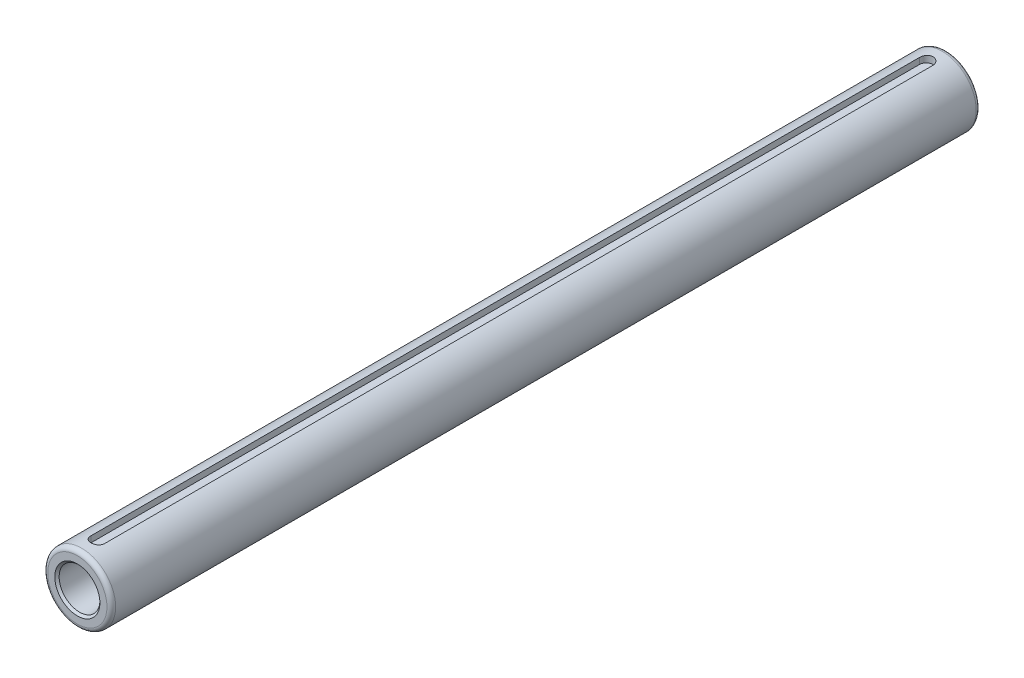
SolidWorks part; units mm, degrees
ref_plane "Front Plane" through (0, 0, 0) normal (0, 0, 1) x (1, 0, 0)
ref_plane "Top Plane" through (0, 0, 0) normal (0, 1, 0) x (1, 0, 0)
ref_plane "Right Plane" through (0, 0, 0) normal (1, 0, 0) x (0, 0, -1)
sketch "Sketch1" plane through (0, 0, 0) normal (0, 0, 1) x (1, 0, 0)
  circle A0 centre (0, 0) radius 9.525
  circle A1 centre (0, 0) radius 15.875
  dimension "D1" = 31.75
  dimension "D2" = 6.35
extrude "Boss-Extrude1" add sketch "Sketch1" along normal mid plane 406.4
sketch "Sketch2" plane through (0, 0, 0) normal (0, 1, 0) x (1, 0, 0)
  line L0 (0, -193.675) -> (0, 193.675) construction
  line L1 (-3.175, -193.675) -> (-3.175, 193.675)
  line L2 (3.175, -193.675) -> (3.175, 193.675)
  line L3 (15.875, 203.2) -> (-15.875, 203.2) construction
  arc A0 (-3.175, -193.675) -> (3.175, -193.675) centre (0, -193.675) ccw
  arc A1 (3.175, 193.675) -> (-3.175, 193.675) centre (0, 193.675) ccw
  point P2 (0, 0)
  dimension "D1" = 9.525
  dimension "D2" = 6.35
extrude "Cut-Extrude1" cut sketch "Sketch2" along normal blind 12.7 from offset 12.7
fillet "Fillet1" radius 2.032 2 edges at (15.875, 0, -203.2) (15.875, 0, 203.2)
chamfer "Chamfer1" distance 1.016 angle 45 2 edges at (9.525, 0, 203.2) (9.525, 0, -203.2)
